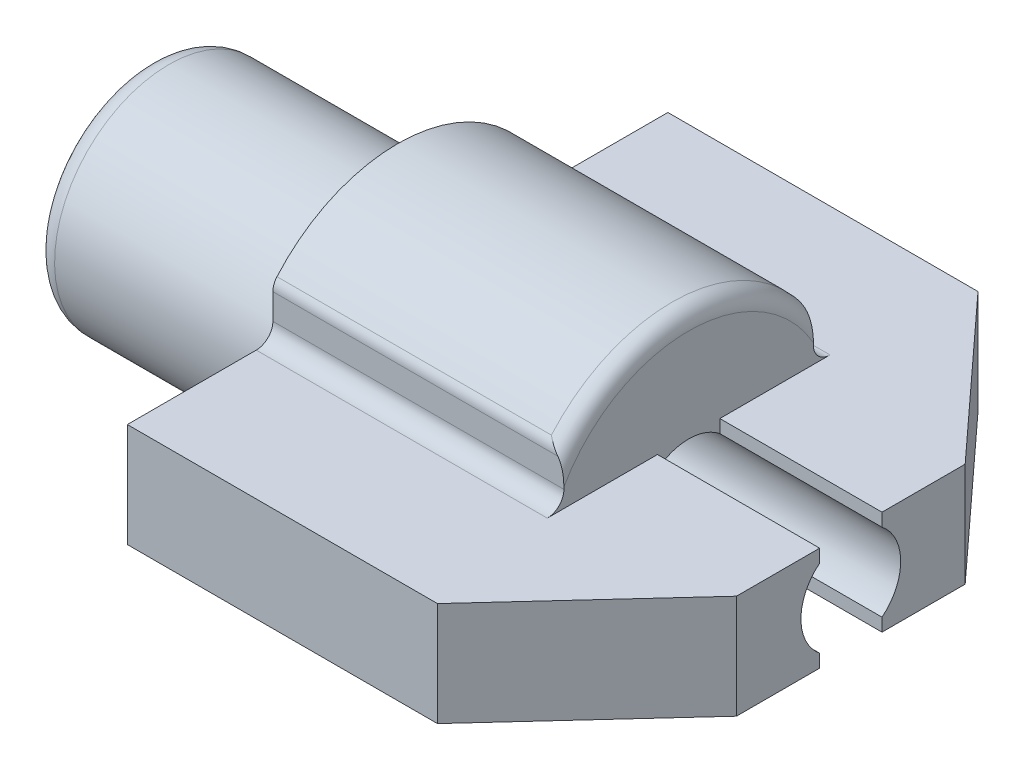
SolidWorks part; units mm, degrees
ref_plane "Přední rovina" through (0, 0, 0) normal (0, 0, 1) x (1, 0, 0)
ref_plane "Horní rovina" through (0, 0, 0) normal (0, 1, 0) x (1, 0, 0)
ref_plane "Pravá rovina" through (0, 0, 0) normal (1, 0, 0) x (0, 0, -1)
sketch "Skica1" plane through (0, 0, 0) normal (0, 0, 1) x (1, 0, 0)
  line L0 (0, 0) -> (0, 5.5)
  line L1 (0, 5.5) -> (12, 5.5)
  line L2 (12, 5.5) -> (12, 14)
  line L3 (12, 14) -> (26, 14)
  line L4 (26, 14) -> (33.8, 5.5)
  line L5 (33.8, 5.5) -> (33.8, 0)
  line L6 (33.8, 0) -> (0, 0)
  dimension "D1" = 5.5
  dimension "D2" = 14
  dimension "D3" = 33.8
  dimension "D4" = 12
  dimension "D5" = 14
  dimension "D6" = 5.5
revolve "Rotovat1" add sketch "Skica1" angle 360 about L6
sketch "Skica2" plane through (12, 0, 0) normal (-1, 0, 0) x (0, 0, 1)
  line L0 (13, 2.5) -> (6, 2.5)
  line L1 (6, 2.5) -> (6, 15.0278)
  line L2 (6, 15.0278) -> (16.6373, 15.0278)
  line L3 (16.6373, 15.0278) -> (16.6373, -15.0278)
  line L4 (0, 0) -> (17.7236, 0) construction
  line L5 (6, -15.0278) -> (16.6373, -15.0278)
  line L6 (6, -2.5) -> (6, -15.0278)
  line L7 (13, -2.5) -> (6, -2.5)
  line L8 (13, 2.5) -> (13, -2.5)
  line L9 (0, 0) -> (0, 15.6441) construction
  line L10 (-13, 2.5) -> (-13, -2.5)
  line L11 (-13, -2.5) -> (-6, -2.5)
  line L12 (-6, -2.5) -> (-6, -15.0278)
  line L13 (-6, -15.0278) -> (-16.6373, -15.0278)
  line L14 (-16.6373, 15.0278) -> (-16.6373, -15.0278)
  line L15 (-6, 15.0278) -> (-16.6373, 15.0278)
  line L16 (-6, 2.5) -> (-6, 15.0278)
  line L17 (-13, 2.5) -> (-6, 2.5)
  dimension "D1" = 5
  dimension "D2" = 13
  dimension "D3" = 6
extrude "Odebrat vysunutím1" cut sketch "Skica2" against normal through all
sketch "Skica3" plane through (12, 0, 0) normal (-1, 0, 0) x (0, 0, 1)
  line L0 (-6.2482, -4) -> (-6.2482, -16.8877)
  line L1 (-6.2482, -4) -> (6.2482, -4)
  line L2 (-6.2482, -16.8877) -> (6.2482, -16.8877)
  line L3 (6.2482, -16.8877) -> (6.2482, -4)
  line L4 (-6.858, 3.5011) -> (-14.1942, 3.5011)
  line L5 (-14.1942, 3.5011) -> (-14.1942, 14.9718)
  line L6 (-14.1942, 14.9718) -> (10.3182, 14.9718)
  line L7 (10.3182, 14.9718) -> (10.3182, 3.5011)
  line L8 (10.3182, 3.5011) -> (6.858, 3.5011)
  arc A0 (6.858, 3.5011) -> (-6.858, 3.5011) centre (0, 0) ccw
  dimension "D1" = 15.4
  dimension "D2" = 4
extrude "Odebrat vysunutím3" cut sketch "Skica3" against normal through all and the other way through all
sketch "Skica4" plane through (0, 0, -6) normal (0, 0, -1) x (-1, 0, 0)
  line L0 (-26.6991, 2.5) -> (-12, 2.5) construction
  line L1 (-26, 2.5) -> (-36, 2.5)
  line L2 (-26, 2.5) -> (-26, 8.5)
  line L3 (-26, 8.5) -> (-36, 8.5)
  line L4 (-36, 2.5) -> (-36, 8.5)
  line L5 (-12, 4.826) -> (-12, 7.7) construction
  dimension "D1" = 14
  dimension "D2" = 10
  dimension "D3" = 6
extrude "Odebrat vysunutím4" cut sketch "Skica4" against normal through all
fillet "Zaoblit1" radius 0.8 5 edges at (19, 2.5, 6) (19, 2.5, -6) (19, 4.826, -6) (19, 4.826, 6) (26, 7.7, 0)
sketch "Skica5" plane through (0, 0, -6) normal (0, 0, -1) x (-1, 0, 0)
  line L0 (-26.6991, -2.5) -> (-12, -2.5) construction
  line L1 (-26, -2.5) -> (-33.8, -2.5)
  line L2 (-26, -2.5) -> (-26, -4)
  line L3 (-26, -4) -> (-33.8, -4)
  line L4 (-33.8, -2.5) -> (-33.8, -4)
  line L5 (-26, 2.5) -> (-26, -2.5) construction
extrude "Odebrat vysunutím5" cut sketch "Skica5" against normal through all
sketch "Skica6" plane through (33.8, 0, 0) normal (1, 0, 0) x (0, 0, -1)
  circle A0 centre (0, 0) radius 2.4
  dimension "D1" = 4.8
extrude "Odebrat vysunutím6" cut sketch "Skica6" against normal blind 24
sketch "Skica7" plane through (0, 2.5, 0) normal (0, 1, 0) x (1, 0, 0)
  line L0 (33.8, -4.899) -> (33.8, 4.899) construction
  line L1 (41.6, 1.5) -> (26, 1.5)
  line L2 (41.6, 1.5) -> (41.6, -1.5)
  line L3 (41.6, -1.5) -> (26, -1.5)
  line L4 (26, 1.5) -> (26, -1.5)
  line L5 (41.6, 1.5) -> (26, -1.5) construction
  line L6 (41.6, -1.5) -> (26, 1.5) construction
  line L7 (26, -6.8) -> (26, 6.8) construction
  point P0 (33.8, 0)
  dimension "D1" = 3
extrude "Odebrat vysunutím7" cut sketch "Skica7" against normal through all
sketch "Skica8" plane through (0, 2.5, 0) normal (0, 1, 0) x (1, 0, 0)
  line L0 (26.6991, 13) -> (26.9176, 13)
  line L1 (26.9176, 13) -> (33.8, 5.5)
  line L2 (33.8, 5.5) -> (33.8, 4.899)
  line L3 (33.8, 4.899) -> (26.6991, 13)
  line L4 (33.8, -4.899) -> (33.8, -5.5)
  line L5 (33.8, -5.5) -> (26.9176, -13)
  line L6 (26.9176, -13) -> (26.6991, -13)
  line L7 (26.6991, -13) -> (33.8, -4.899)
extrude "Přidat vysunutím1" add sketch "Skica8" against normal up to surface (5 mm away)
fillet "Zaoblit2" radius 1 1 edges at (0, 5.5, 0)
fillet "Zaoblit3" radius 0.2 4 edges at (26, -2.5, -3.75) (26, -2.5, 3.75) (19, -2.5, 6) (19, -2.5, -6)
